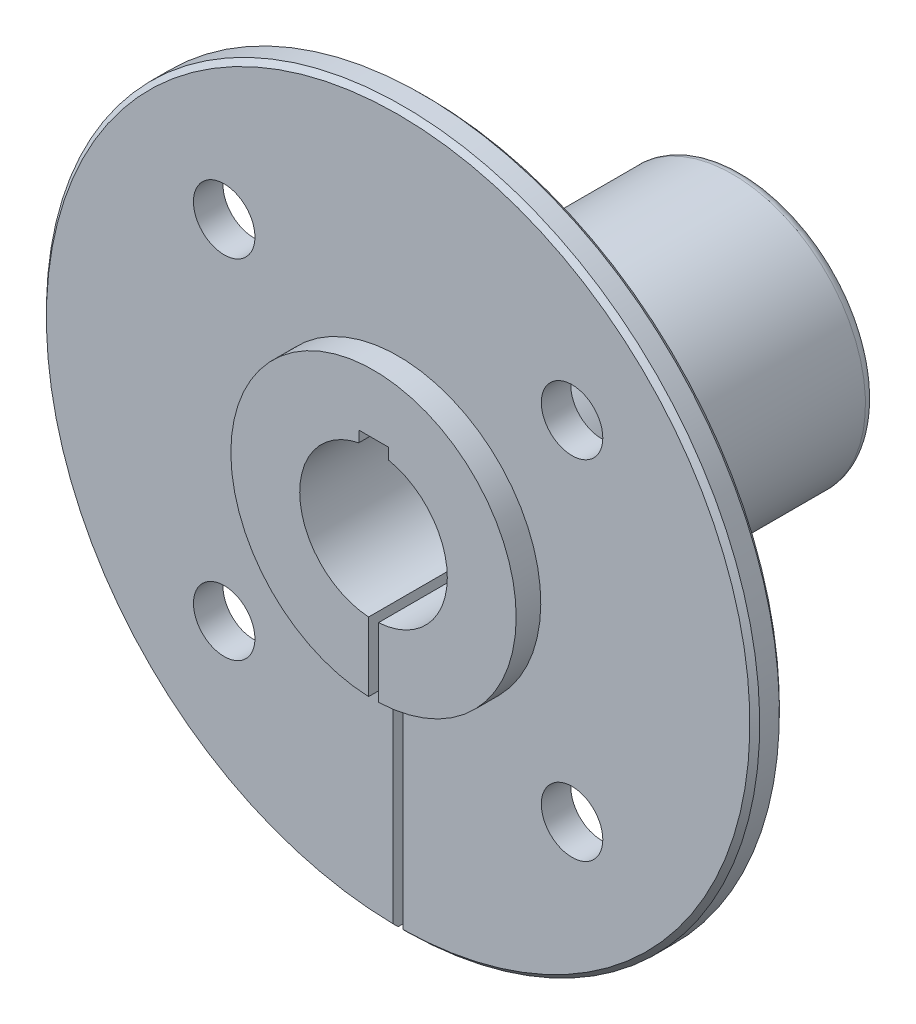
SolidWorks part; units mm, degrees
ref_plane "Ebene vorne" through (0, 0, 0) normal (0, 0, 1) x (1, 0, 0)
ref_plane "Ebene oben" through (0, 0, 0) normal (0, 1, 0) x (1, 0, 0)
ref_plane "Ebene rechts" through (0, 0, 0) normal (1, 0, 0) x (0, 0, -1)
sketch "Skizze1" plane through (0, 0, 0) normal (0, 0, 1) x (1, 0, 0)
  circle A0 centre (0, 0) radius 15
  circle A1 centre (0, 0) radius 27
  dimension "D1" = 54
  dimension "D2" = 30
extrude "Linear austragen1" add sketch "Skizze1" along normal blind 64
sketch "Skizze2" plane through (0, 0, 64) normal (0, 0, 1) x (1, 0, 0)
  line L0 (0, 0) -> (0, -66.0318) construction
  line L1 (0, 67.7631) -> (0, 45.8282) construction
  line L2 (0, 67.7631) -> (0, -46.5252) construction
  line L3 (-63.0449, 0) -> (52.8854, 0) construction
  circle A3 centre (0, 0) radius 15
  circle A6 centre (0, 0) radius 72.5
  dimension "D1" = 145
extrude "Linear austragen2" add sketch "Skizze2" along normal blind 6
sketch "Skizze7" plane through (0, 0, 70) normal (0, 0, 1) x (1, 0, 0)
  circle A0 centre (0, 0) radius 29
  circle A1 centre (0, 0) radius 15
  dimension "D1" = 30
  dimension "D2" = 58
extrude "Linear austragen3" add sketch "Skizze7" along normal blind 5
fillet "Verrundung1" radius 2 1 edges at (27, 0, 0)
sketch "Skizze8" plane through (0, 0, 75) normal (0, 0, 1) x (1, 0, 0)
  line L0 (0, 32.8441) -> (0, -8.9113) construction
  line L2 (-3, 16.9469) -> (3, 16.9469)
  line L3 (-3, 16.9469) -> (-3, 14.6969)
  line L4 (-3, 14.6969) -> (3, 14.6969)
  line L5 (3, 16.9469) -> (3, 14.6969)
  circle A0 centre (0, 0) radius 15 construction
  circle A1 centre (0, 0) radius 15
  dimension "D1" = 6
  dimension "D2" = 3
  dimension "D3" = 2.25
extrude "Schnitt-Linear austragen1" cut sketch "Skizze8" against normal through all
sketch "Skizze9" plane through (0, 0, 70) normal (0, 0, 1) x (1, 0, 0)
  line L0 (0, 0) -> (35.3553, 35.3553) construction
  line L1 (35.3553, 35.3553) -> (0, 0) construction
  line L2 (0, 0) -> (-39.6123, -39.6123) construction
  line L3 (0, 0) -> (-38.4665, 38.4665) construction
  line L4 (0, 0) -> (34.4258, -34.4258) construction
  line L5 (-65.247, 0) -> (62.2745, 0) construction
  point P6 (35.3553, 35.3553)
  point P12 (35.3553, -35.3553)
  point P15 (-35.3553, -35.3553)
  point P16 (-35.3553, 35.3553)
  dimension "D1" = 45
  dimension "D2" = 50
  dimension "D3" = 50
  dimension "D4" = 50
  dimension "D6" = 100
chamfer "Fase1" distance 1 angle 45 2 edges at (72.5, 0, 64) (72.5, 0, 70)
fillet "Verrundung2" radius 10 1 edges at (27, 0, 64)
hole_wizard "Ø12.5 (12.5) Durchmesser Bohrung1" positions "3D-Skizze1" profile "Skizze10" hole size "Ø12.5" standard "DIN"
sketch3d "3D-Skizze1"
  point P0 (-35.3553, 35.3553, 70)
  point P2 (35.3553, 35.3553, 70)
  point P4 (35.3553, -35.3553, 70)
  point P6 (-35.3553, -35.3553, 70)
sketch "Skizze10" plane through (-35.3553, 35.3553, 70) normal (1, 0, 0) x (0, -1, 0)
  line L0 (0, 0) -> (0, 6)
  line L1 (0, 6) -> (6.25, 6)
  line L2 (6.25, 6) -> (6.25, 0)
  line L5 (6.25, 0) -> (0, 0)
  line L11 (0, -6.35) -> (0, 107.95) construction
  dimension "Bohrerdurchmesser" = 12.5
  dimension "Bohrungstiefe" = 6
sketch "Skizze11" plane through (0, 0, 0) normal (0, 0, 1) x (1, 0, 0)
  line L0 (0, 0) -> (0, -82.7989) construction
  line L1 (1, -14.6177) -> (-1, -14.6177)
  line L2 (-1, -14.6177) -> (-1, -71.493)
  line L3 (1, -71.493) -> (1, -72.5987)
  line L4 (1, -71.493) -> (1, -14.6177)
  line L5 (1, -72.5987) -> (-1, -72.5987)
  line L6 (-1, -72.5987) -> (-1, -71.493)
  circle A0 centre (0, 0) radius 71.5 construction
  dimension "D1" = 2
  dimension "D2" = 1
extrude "Schnitt-Linear austragen2" cut sketch "Skizze11" along normal through all
sketch "Skizze12" plane through (0, 0, 0) normal (1, 0, 0) x (0, 0, -1)
  line L0 (0, -24.98) -> (0, 25) construction
  line L1 (-54, -26.9815) -> (-2, -26.9815) construction
  circle A0 centre (-15, -20.9815) radius 2.75
  circle A1 centre (-40, -20.9815) radius 2.75
  point P0 (-15, -20.9815)
  point P1 (-40, -20.9815)
  dimension "D1" = 15
  dimension "D3" = 6
  dimension "D5" = 5.5
  dimension "D2" = 25
  dimension "D4" = 6
extrude "Schnitt-Linear austragen3" cut sketch "Skizze12" against normal up to next
ref_plane "Ebene1" through (1, 0, 0) normal (-1, 0, 0) x (0, 0, 1)
sketch "Skizze13" plane through (1, 0, 0) normal (-1, 0, 0) x (0, 0, 1)
  point P0 (40, -20.9815)
  point P1 (15, -20.9815)
hole_wizard "M5x0.8 Gewindekernloch1" positions "3D-Skizze2" profile "Skizze14" tap size "M5x0.8" standard "DIN"
sketch3d "3D-Skizze2"
  point P0 (1, -20.9815, 40)
  point P2 (1, -20.9815, 15)
sketch "Skizze14" plane through (1, -20.9815, 40) normal (0, 1, 0) x (0, 0, 1)
  line L0 (0, 0) -> (0, 13.6618)
  line L1 (0, 13.6618) -> (2.1, 12.4)
  line L2 (2.1, 12.4) -> (2.1, 10)
  line L3 (2.1, 10) -> (2.5, 10)
  line L4 (2.5, 10) -> (2.5, 0)
  line L5 (2.5, 0) -> (0, 0)
  line L10 (0, 13.6618) -> (-2.1, 12.4) construction
  line L11 (0, -6.35) -> (0, 107.95) construction
  dimension "Bohrerdurchmesser" = 4.2
  dimension "Bohrungstiefe" = 12.4
  dimension "Nenndurchmesser" = 5
  dimension "Gewindelänge" = 10
  dimension "Spitzenwinkel" = 118
ref_plane "Ebene2" through (-7.5, 0, 0) normal (1, 0, 0) x (0, 0, -1)
sketch "Skizze15" plane through (-7.5, 0, 0) normal (1, 0, 0) x (0, 0, -1)
  circle A0 centre (-15, -20.9815) radius 5
  circle A1 centre (-40, -20.9815) radius 5
extrude "Schnitt-Linear austragen4" cut sketch "Skizze15" against normal up to next
